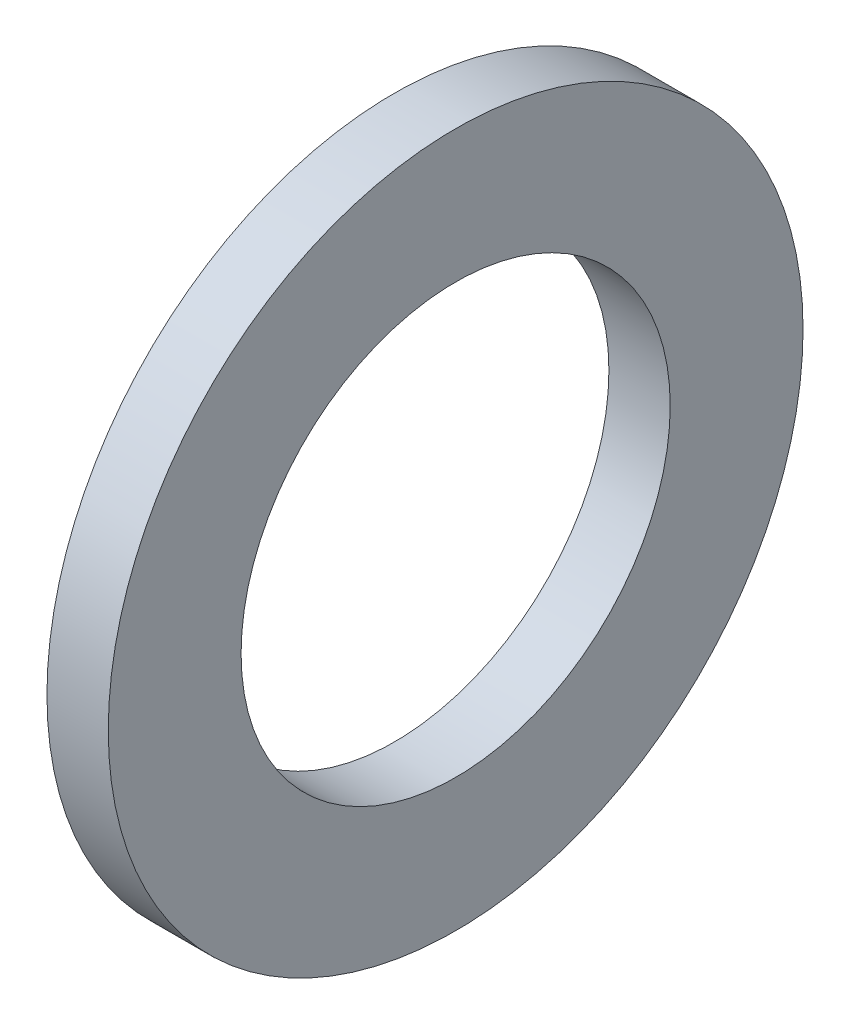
SolidWorks part; units mm, degrees
ref_plane "Plane1" through (0, 0, 0) normal (0, 0, 1) x (1, 0, 0)
ref_plane "Plane2" through (0, 0, 0) normal (0, 1, 0) x (1, 0, 0)
ref_plane "Plane3" through (0, 0, 0) normal (1, 0, 0) x (0, 0, -1)
other "Configuration Table"
sketch "Sketch1" plane through (0, 0, 0) normal (0, 0, 1) x (1, 0, 0)
  line L0 (-34.925, 0) -> (9.525, 0) construction
  line L1 (0, 10.5) -> (0, 17)
  line L2 (0, 17) -> (-3, 17)
  line L3 (-3, 17) -> (-3, 10.5)
  line L4 (-3, 10.5) -> (0, 10.5)
  dimension "Thickness" = 3
  dimension "Inside_dia" = 21
  dimension "Outside_dia" = 34
revolve "Base-Revolve" add sketch "Sketch1" angle 360 about L0
